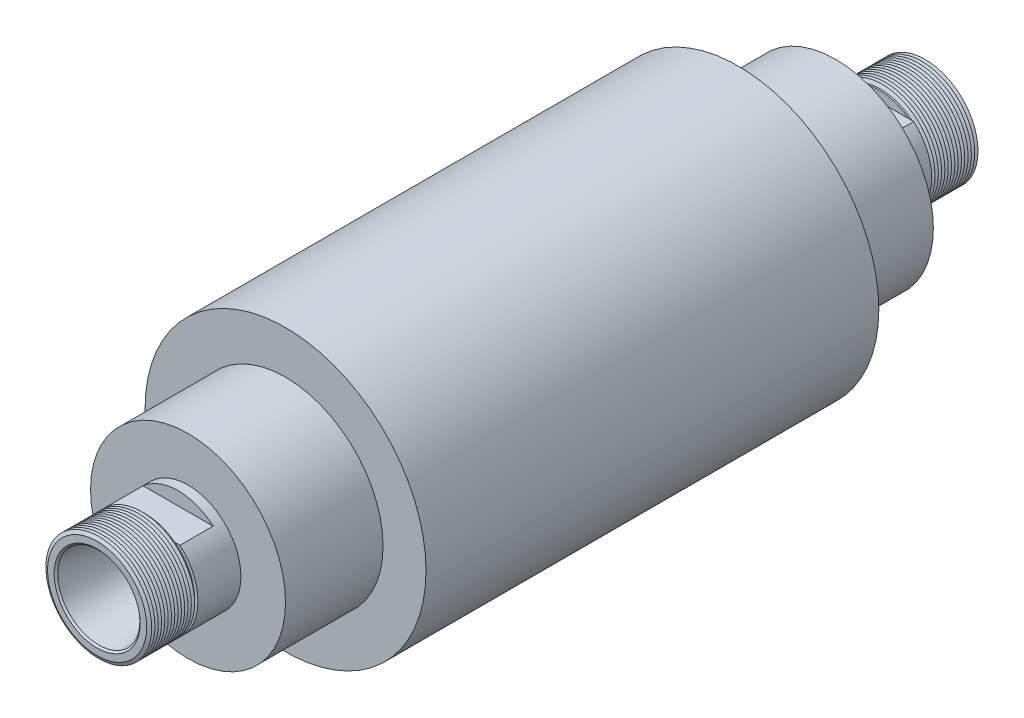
SolidWorks part; units mm, degrees
ref_plane "Front Plane" through (0, 0, 0) normal (0, 0, 1) x (1, 0, 0)
ref_plane "Top Plane" through (0, 0, 0) normal (0, 1, 0) x (1, 0, 0)
ref_plane "Right Plane" through (0, 0, 0) normal (1, 0, 0) x (0, 0, -1)
sketch "Sketch1" plane through (0, 0, 0) normal (1, 0, 0) x (0, 0, -1)
  line L0 (-1375.9824, 0) -> (67423.1361, 0) construction
  line L1 (0, -1375.9824) -> (0, 67423.1361) construction
  line L2 (0, 42.5) -> (-68.5, 42.5)
  line L3 (-68.5, 42.5) -> (-68.5, 29.5)
  line L4 (-68.5, 29.5) -> (-98, 29.5)
  line L5 (-98, 29.5) -> (-98, 16)
  line L6 (-98, 16) -> (-111, 16)
  line L7 (-125.5, 15) -> (-125.5, 13)
  line L8 (-125.0049, 12.4304) -> (-95.5, 8.2838)
  line L9 (-95.5, 8.2838) -> (-41.0345, 8.2838)
  line L10 (-41.0345, 8.2838) -> (-41.0345, 0)
  line L11 (-41.0345, 0) -> (0, 0)
  line L12 (0, 0) -> (0, 42.5)
  line L13 (-125.5, 13) -> (-125.0049, 12.4304)
  line L14 (-111, 16) -> (-111, 15)
  line L15 (-111.5, 15) -> (-111, 15)
  line L17 (-125.5, 15) -> (-125, 16)
  line L18 (-125, 16) -> (-124.5, 15)
  line L19 (-124.5, 15) -> (-124, 16)
  line L20 (-124, 16) -> (-123.5, 15)
  line L21 (-123.5, 15) -> (-123, 16)
  line L22 (-123, 16) -> (-122.5, 15)
  line L23 (-122.5, 15) -> (-122, 16)
  line L24 (-122, 16) -> (-121.5, 15)
  line L25 (-121.5, 15) -> (-121, 16)
  line L26 (-121, 16) -> (-120.5, 15)
  line L27 (-120.5, 15) -> (-120, 16)
  line L28 (-120, 16) -> (-119.5, 15)
  line L29 (-119.5, 15) -> (-119, 16)
  line L30 (-119, 16) -> (-118.5, 15)
  line L31 (-118.5, 15) -> (-118, 16)
  line L32 (-118, 16) -> (-117.5, 15)
  line L33 (-117.5, 15) -> (-117, 16)
  line L34 (-117, 16) -> (-116.5, 15)
  line L35 (-116.5, 15) -> (-116, 16)
  line L36 (-116, 16) -> (-115.5, 15)
  line L37 (-115.5, 15) -> (-115, 16)
  line L38 (-115, 16) -> (-114.5, 15)
  line L39 (-114.5, 15) -> (-114, 16)
  line L40 (-114, 16) -> (-113.5, 15)
  line L41 (-113.5, 15) -> (-113, 16)
  line L42 (-113, 16) -> (-112.5, 15)
  line L43 (-112.5, 15) -> (-112, 16)
  line L44 (-112, 16) -> (-111.5, 15)
  line L47 (-111, 16) -> (-110.5, 15)
  line L48 (-111.5, 15) -> (-111, 16)
  point P12 (-125.5, 12.5)
  dimension "D1" = 42.5
  dimension "D2" = 15
  dimension "D3" = 29.5
  dimension "D4" = 125.5
  dimension "D5" = 29.5
  dimension "D6" = 12.5
  dimension "D12" = 30
revolve "Revolve1" add sketch "Sketch1" angle 360 about L0
mirror "Mirror1" about plane through (0, 0, 0) normal (0, 0, 1) of "Revolve1"
sketch "Sketch2" plane through (0, 0, 0) normal (0, 1, 0) x (1, 0, 0)
  line L0 (-1000, 0) -> (49000, 0) construction
  line L1 (-36.4822, 111) -> (36.4822, 111)
  line L2 (-36.4822, 111) -> (-36.4822, 101)
  line L3 (-36.4822, 101) -> (36.4822, 101)
  line L4 (36.4822, 111) -> (36.4822, 101)
  line L5 (-36.4822, -101) -> (36.4822, -101)
  line L6 (-36.4822, -101) -> (-36.4822, -111)
  line L7 (-36.4822, -111) -> (36.4822, -111)
  line L8 (36.4822, -101) -> (36.4822, -111)
  line L9 (0, -1000) -> (0, 49000) construction
  line L10 (-15, -111) -> (15, -111) construction
  dimension "D1" = 10
extrude "Cut-Extrude1" cut sketch "Sketch2" along normal blind 10 from offset 12
mirror "Mirror2" about plane through (0, 0, 0) normal (0, 1, 0) of "Cut-Extrude1"
